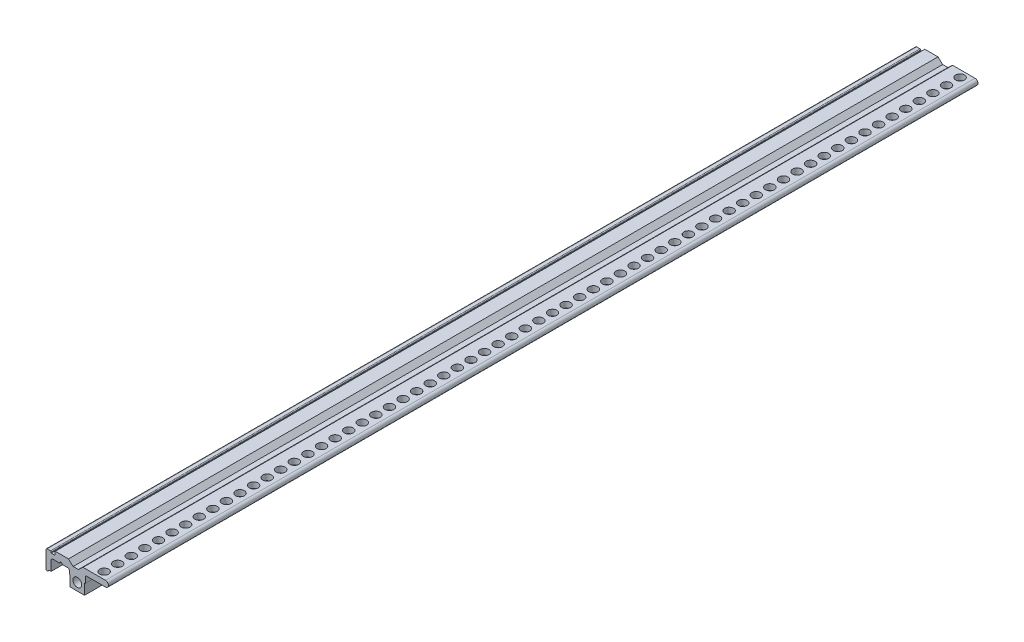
SolidWorks part; units mm, degrees
ref_plane "前视基准面" through (0, 0, 0) normal (0, 0, 1) x (1, 0, 0)
ref_plane "上视基准面" through (0, 0, 0) normal (0, 1, 0) x (1, 0, 0)
ref_plane "右视基准面" through (0, 0, 0) normal (1, 0, 0) x (0, 0, -1)
sketch "草图1" plane through (0, 0, 0) normal (0, 0, 1) x (1, 0, 0)
  line L2 (2426.9819, -3175.6208) -> (2418.5819, -3175.6208)
  line L3 (2418.5819, -3175.6208) -> (2416.8319, -3177.2208)
  line L4 (2416.8319, -3177.2208) -> (2414.8819, -3177.2208)
  line L5 (2414.8819, -3177.2208) -> (2413.1319, -3175.6208)
  line L6 (2413.1319, -3175.6208) -> (2408.1819, -3175.6208)
  line L7 (2408.1819, -3175.6208) -> (2408.1819, -3176.9708)
  line L8 (2408.1819, -3176.9708) -> (2406.6819, -3176.9708)
  line L9 (2406.6819, -3176.9708) -> (2406.6819, -3176.6708)
  line L10 (2406.3819, -3176.3708) -> (2405.1319, -3176.3708)
  line L11 (2404.7319, -3176.7708) -> (2404.7319, -3183.1708)
  line L12 (2405.0319, -3183.4708) -> (2405.2319, -3183.4708)
  line L13 (2406.2711, -3182.8708) -> (2406.6819, -3182.8708)
  line L14 (2406.6819, -3182.8708) -> (2406.6819, -3179.1208)
  line L15 (2407.1819, -3178.6208) -> (2409.8319, -3178.6208)
  line L16 (2410.8319, -3178.6208) -> (2412.9319, -3178.6208)
  line L17 (2413.4319, -3179.1208) -> (2413.4319, -3180.4208)
  line L18 (2413.4319, -3180.4208) -> (2413.7319, -3180.4208)
  line L19 (2413.7319, -3180.4208) -> (2413.7319, -3184.4208)
  line L20 (2413.7319, -3184.4208) -> (2419.1319, -3184.4208)
  line L21 (2419.1319, -3184.4208) -> (2419.1319, -3180.4208)
  line L22 (2419.1319, -3180.4208) -> (2419.4319, -3180.4208)
  line L23 (2419.4319, -3180.4208) -> (2419.4319, -3178.3208)
  line L24 (2419.9319, -3177.8208) -> (2426.9819, -3177.8208)
  circle A0 centre (2416.4319, -3181.5808) radius 1.5
  arc A1 (2406.6819, -3176.6708) -> (2406.3819, -3176.3708) centre (2406.3819, -3176.6708) ccw
  arc A2 (2405.1319, -3176.3708) -> (2404.7319, -3176.7708) centre (2405.1319, -3176.7708) ccw
  arc A3 (2404.7319, -3183.1708) -> (2405.0319, -3183.4708) centre (2405.0319, -3183.1708) ccw
  arc A4 (2405.2319, -3183.4708) -> (2405.4917, -3183.3208) centre (2405.2319, -3183.1708) ccw
  arc A5 (2406.2711, -3182.8708) -> (2405.4917, -3183.3208) centre (2406.2711, -3183.7708) ccw
  arc A6 (2407.1819, -3178.6208) -> (2406.6819, -3179.1208) centre (2407.1819, -3179.1208) ccw
  arc A7 (2410.8319, -3178.6208) -> (2409.8319, -3178.6208) centre (2410.3319, -3178.6208) ccw
  arc A8 (2413.4319, -3179.1208) -> (2412.9319, -3178.6208) centre (2412.9319, -3179.1208) ccw
  arc A9 (2419.9319, -3177.8208) -> (2419.4319, -3178.3208) centre (2419.9319, -3178.3208) ccw
  arc A10 (2426.9819, -3177.8208) -> (2426.9819, -3175.6208) centre (2426.9819, -3176.7208) ccw
  dimension "D1" = 3
extrude "凸台-拉伸1" add sketch "草图1" along normal mid plane 325.12
hole_wizard "M4 螺纹孔1" positions "3D草图1" profile "草图2" tap size "M4" standard "Gb"
sketch3d "3D草图1"
  line L0 (2416.4319, -3181.5808, 162.56) -> (2416.4319, -3181.5808, -162.56) construction
  point P0 (2416.4319, -3181.5808, 162.56)
  point P4 (2416.4319, -3181.5808, -162.56)
sketch "草图2" plane through (2416.4319, -3181.5808, 162.56) normal (1, 0, 0) x (0, -1, 0)
  line L0 (0, 0) -> (0, 15.9914)
  line L1 (0, 15.9914) -> (1.65, 15)
  line L2 (1.65, 15) -> (1.65, 0)
  line L5 (1.65, 0) -> (0, 0)
  line L10 (0, 15.9914) -> (-1.65, 15) construction
  line L11 (0, -6.35) -> (0, 107.95) construction
  dimension "螺纹孔钻头直径" = 3.3
  dimension "螺纹孔钻头深度" = 15
  dimension "导头角度" = 118
sketch "草图3" plane through (0, -3175.6208, 0) normal (0, 1, 0) x (1, 0, 0)
  line L0 (2426.9819, -162.56) -> (2418.5819, -162.56) construction
  line L1 (2428.0819, -162.56) -> (2428.0819, 162.56) construction
  circle A0 centre (2423.9319, -160.02) radius 1.65
  circle A1 centre (2423.9319, -154.94) radius 1.65
  circle A2 centre (2423.9319, -149.86) radius 1.65
  circle A3 centre (2423.9319, -144.78) radius 1.65
  circle A4 centre (2423.9319, -139.7) radius 1.65
  circle A5 centre (2423.9319, -134.62) radius 1.65
  circle A6 centre (2423.9319, -129.54) radius 1.65
  circle A7 centre (2423.9319, -124.46) radius 1.65
  circle A8 centre (2423.9319, -119.38) radius 1.65
  circle A9 centre (2423.9319, -114.3) radius 1.65
  circle A10 centre (2423.9319, -109.22) radius 1.65
  circle A11 centre (2423.9319, -104.14) radius 1.65
  circle A12 centre (2423.9319, -99.06) radius 1.65
  circle A13 centre (2423.9319, -93.98) radius 1.65
  circle A14 centre (2423.9319, -88.9) radius 1.65
  circle A15 centre (2423.9319, -83.82) radius 1.65
  circle A16 centre (2423.9319, -78.74) radius 1.65
  circle A17 centre (2423.9319, -73.66) radius 1.65
  circle A18 centre (2423.9319, -68.58) radius 1.65
  circle A19 centre (2423.9319, -63.5) radius 1.65
  circle A20 centre (2423.9319, -58.42) radius 1.65
  circle A21 centre (2423.9319, -53.34) radius 1.65
  circle A22 centre (2423.9319, -48.26) radius 1.65
  circle A23 centre (2423.9319, -43.18) radius 1.65
  circle A24 centre (2423.9319, -38.1) radius 1.65
  circle A25 centre (2423.9319, -33.02) radius 1.65
  circle A26 centre (2423.9319, -27.94) radius 1.65
  circle A27 centre (2423.9319, -22.86) radius 1.65
  circle A28 centre (2423.9319, -17.78) radius 1.65
  circle A29 centre (2423.9319, -12.7) radius 1.65
  circle A30 centre (2423.9319, -7.62) radius 1.65
  circle A31 centre (2423.9319, -2.54) radius 1.65
  circle A32 centre (2423.9319, 2.54) radius 1.65
  circle A33 centre (2423.9319, 7.62) radius 1.65
  circle A34 centre (2423.9319, 12.7) radius 1.65
  circle A35 centre (2423.9319, 17.78) radius 1.65
  circle A36 centre (2423.9319, 22.86) radius 1.65
  circle A37 centre (2423.9319, 27.94) radius 1.65
  circle A38 centre (2423.9319, 33.02) radius 1.65
  circle A39 centre (2423.9319, 38.1) radius 1.65
  circle A40 centre (2423.9319, 43.18) radius 1.65
  circle A41 centre (2423.9319, 48.26) radius 1.65
  circle A42 centre (2423.9319, 53.34) radius 1.65
  circle A43 centre (2423.9319, 58.42) radius 1.65
  circle A44 centre (2423.9319, 63.5) radius 1.65
  circle A45 centre (2423.9319, 68.58) radius 1.65
  circle A46 centre (2423.9319, 73.66) radius 1.65
  circle A47 centre (2423.9319, 78.74) radius 1.65
  circle A48 centre (2423.9319, 83.82) radius 1.65
  circle A49 centre (2423.9319, 88.9) radius 1.65
  circle A50 centre (2423.9319, 93.98) radius 1.65
  circle A51 centre (2423.9319, 99.06) radius 1.65
  circle A52 centre (2423.9319, 104.14) radius 1.65
  circle A53 centre (2423.9319, 109.22) radius 1.65
  circle A54 centre (2423.9319, 114.3) radius 1.65
  circle A55 centre (2423.9319, 119.38) radius 1.65
  circle A56 centre (2423.9319, 124.46) radius 1.65
  circle A57 centre (2423.9319, 129.54) radius 1.65
  circle A58 centre (2423.9319, 134.62) radius 1.65
  circle A59 centre (2423.9319, 139.7) radius 1.65
  circle A60 centre (2423.9319, 144.78) radius 1.65
  circle A61 centre (2423.9319, 149.86) radius 1.65
  circle A62 centre (2423.9319, 154.94) radius 1.65
  circle A63 centre (2423.9319, 160.02) radius 1.65
extrude "切除-拉伸1" cut sketch "草图3" against normal blind 431.8
sketch "草图4" plane through (2404.7319, 0, 0) normal (-1, 0, 0) x (0, 0, 1)
  line L0 (-162.56, -3176.7708) -> (-162.56, -3183.1708) construction
  line L1 (162.56, -3175.6208) -> (-162.56, -3175.6208) construction
  circle A0 centre (-157.48, -3180.8708) radius 1
  circle A1 centre (-152.4, -3180.8708) radius 1
  circle A2 centre (-147.32, -3180.8708) radius 1
  circle A3 centre (-142.24, -3180.8708) radius 1
  circle A4 centre (-137.16, -3180.8708) radius 1
  circle A5 centre (-132.08, -3180.8708) radius 1
  circle A6 centre (-127, -3180.8708) radius 1
  circle A7 centre (-121.92, -3180.8708) radius 1
  circle A8 centre (-116.84, -3180.8708) radius 1
  circle A9 centre (-111.76, -3180.8708) radius 1
  circle A10 centre (-106.68, -3180.8708) radius 1
  circle A11 centre (-101.6, -3180.8708) radius 1
  circle A12 centre (-96.52, -3180.8708) radius 1
  circle A13 centre (-91.44, -3180.8708) radius 1
  circle A14 centre (-86.36, -3180.8708) radius 1
  circle A15 centre (-81.28, -3180.8708) radius 1
  circle A16 centre (-76.2, -3180.8708) radius 1
  circle A17 centre (-71.12, -3180.8708) radius 1
  circle A18 centre (-66.04, -3180.8708) radius 1
  circle A19 centre (-60.96, -3180.8708) radius 1
  circle A20 centre (-55.88, -3180.8708) radius 1
  circle A21 centre (-50.8, -3180.8708) radius 1
  circle A22 centre (-45.72, -3180.8708) radius 1
  circle A23 centre (-40.64, -3180.8708) radius 1
  circle A24 centre (-35.56, -3180.8708) radius 1
  circle A25 centre (-30.48, -3180.8708) radius 1
  circle A26 centre (-25.4, -3180.8708) radius 1
  circle A27 centre (-20.32, -3180.8708) radius 1
  circle A28 centre (-15.24, -3180.8708) radius 1
  circle A29 centre (-10.16, -3180.8708) radius 1
  circle A30 centre (-5.08, -3180.8708) radius 1
  circle A31 centre (0, -3180.8708) radius 1
  circle A32 centre (5.08, -3180.8708) radius 1
  circle A33 centre (10.16, -3180.8708) radius 1
  circle A34 centre (15.24, -3180.8708) radius 1
  circle A35 centre (20.32, -3180.8708) radius 1
  circle A36 centre (25.4, -3180.8708) radius 1
  circle A37 centre (30.48, -3180.8708) radius 1
  circle A38 centre (35.56, -3180.8708) radius 1
  circle A39 centre (40.64, -3180.8708) radius 1
  circle A40 centre (45.72, -3180.8708) radius 1
  circle A41 centre (50.8, -3180.8708) radius 1
  circle A42 centre (55.88, -3180.8708) radius 1
  circle A43 centre (60.96, -3180.8708) radius 1
  circle A44 centre (66.04, -3180.8708) radius 1
  circle A45 centre (71.12, -3180.8708) radius 1
  circle A46 centre (76.2, -3180.8708) radius 1
  circle A47 centre (81.28, -3180.8708) radius 1
  circle A48 centre (86.36, -3180.8708) radius 1
  circle A49 centre (91.44, -3180.8708) radius 1
  circle A50 centre (96.52, -3180.8708) radius 1
  circle A51 centre (101.6, -3180.8708) radius 1
  circle A52 centre (106.68, -3180.8708) radius 1
  circle A53 centre (111.76, -3180.8708) radius 1
  circle A54 centre (116.84, -3180.8708) radius 1
  circle A55 centre (121.92, -3180.8708) radius 1
  circle A56 centre (127, -3180.8708) radius 1
  circle A57 centre (132.08, -3180.8708) radius 1
  circle A58 centre (137.16, -3180.8708) radius 1
  circle A59 centre (142.24, -3180.8708) radius 1
  circle A60 centre (147.32, -3180.8708) radius 1
  circle A61 centre (152.4, -3180.8708) radius 1
  circle A62 centre (157.48, -3180.8708) radius 1
extrude "切除-拉伸2" cut sketch "草图4" against normal blind 3
hole_wizard "M2.5 螺纹孔1" positions "3D草图2" profile "草图5" tap size "M2.5" standard "Gb"
sketch3d "3D草图2"
  line L0 (2406.6819, -3180.8708, -157.48) -> (2404.7319, -3180.8708, -157.48) construction
  line L1 (2404.7319, -3183.1708, -162.56) -> (2404.7319, -3183.1708, 162.56) construction
  point P0 (2404.7319, -3180.8708, -157.48)
  dimension "D1" = 325.12
sketch "草图5" plane through (2404.7319, -3180.8708, -157.48) normal (0, 1, 0) x (0, 0, 1)
  line L0 (0, 0) -> (0, 6.9659)
  line L1 (0, 6.9659) -> (1.025, 6.35)
  line L2 (1.025, 6.35) -> (1.025, 0)
  line L5 (1.025, 0) -> (0, 0)
  line L10 (0, 6.9659) -> (-1.025, 6.35) construction
  line L11 (0, -6.35) -> (0, 107.95) construction
  dimension "螺纹孔钻头直径" = 2.05
  dimension "螺纹孔钻头深度" = 6.35
  dimension "导头角度" = 118
pattern_linear "阵列(线性)1" count 63 spacing 5.08 along (0, 0, 1) of "M2.5 螺纹孔1"
equation "\"D4@草图3\"=\"D1@凸台-拉伸1\"/5.08"
equation "\"D4@草图4\"=\"D1@凸台-拉伸1\"/5.08-1"
